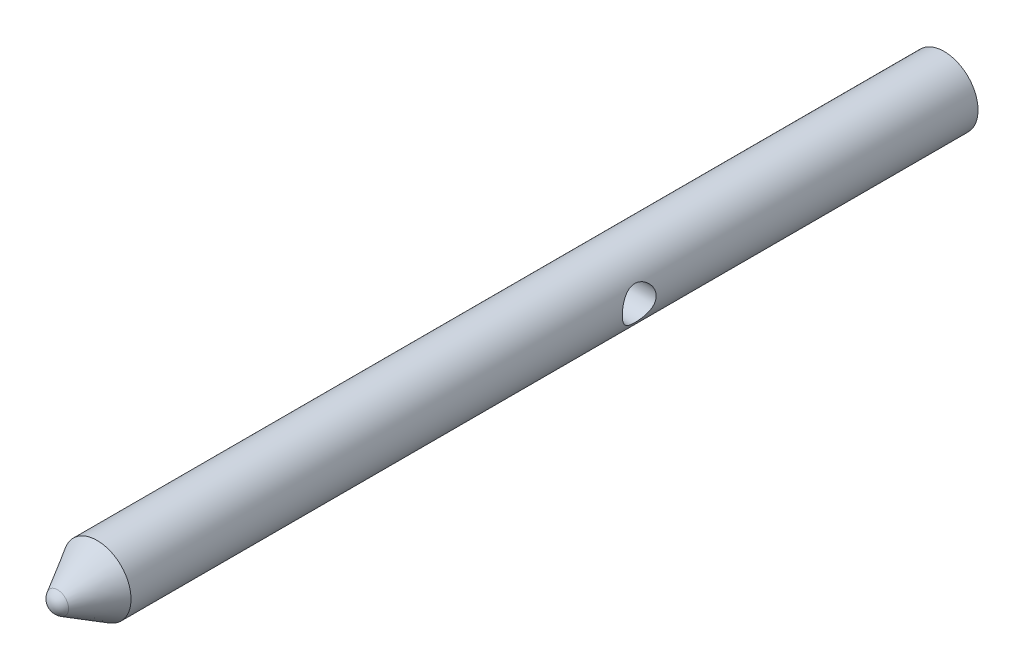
SolidWorks part; units mm, degrees
ref_plane "Front Plane" through (0, 0, 0) normal (0, 0, 1) x (1, 0, 0)
ref_plane "Top Plane" through (0, 0, 0) normal (0, 1, 0) x (1, 0, 0)
ref_plane "Right Plane" through (0, 0, 0) normal (1, 0, 0) x (0, 0, -1)
ref_axis "Axis1" through (0, 0, -5) along (0, 0, 1)
sketch "Sketch4" plane through (0, 0, 0) normal (1, 0, 0) x (0, 0, -1)
  line L0 (0, 0) -> (0, 4)
  line L1 (0, 4) -> (-100, 4)
  line L2 (-100, 4) -> (-104.6782, 1.299)
  line L3 (5, 0) -> (-105, 0) construction
  line L4 (-105.4282, 0) -> (0, 0)
  arc A0 (-105.4282, 0) -> (-104.6782, 1.299) centre (-103.9282, 0) cw
  dimension "D4" = 1.5
  dimension "D1" = 30
  dimension "D2" = 4
  dimension "D3" = 100
revolve "Revolve2" add sketch "Sketch4" angle 360 about axis through (0, 0, -5) along (0, 0, 1)
sketch "Sketch5" plane through (0, 0, 0) normal (1, 0, 0) x (0, 0, -1)
  line L0 (5, 0) -> (-105, 0) construction
  line L1 (0, -4) -> (0, 4) construction
  circle A0 centre (-40, 0) radius 2
  dimension "D1" = 4
  dimension "D2" = 40
extrude "Cut-Extrude1" cut sketch "Sketch5" against normal through all both and the other way through all
ref_point "Point1"
